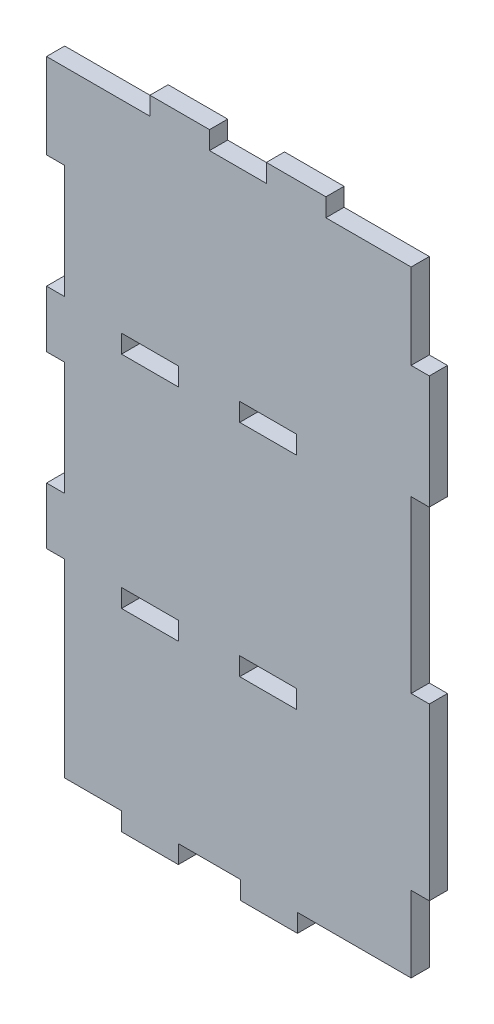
SolidWorks part; units mm, degrees
ref_plane "Front Plane" through (0, 0, 0) normal (0, 0, 1) x (1, 0, 0)
ref_plane "Top Plane" through (0, 0, 0) normal (0, 1, 0) x (1, 0, 0)
ref_plane "Right Plane" through (0, 0, 0) normal (1, 0, 0) x (0, 0, -1)
sketch "Sketch1" plane through (0, 0, 0) normal (0, 0, 1) x (1, 0, 0)
  line L0 (181.3709, 646.8) -> (233.7709, 646.8)
  line L1 (103.9709, 89) -> (158.7709, 89)
  line L2 (3.9709, 89) -> (3.9709, 630.8)
  line L3 (78.9709, 646.8) -> (131.3709, 646.8)
  line L4 (308.7709, 89) -> (308.7709, 630.8)
  line L5 (208.7709, 89) -> (158.7709, 89)
  line L6 (-4.0291, 555.8) -> (-4.0291, 455.8) construction
  line L7 (233.7709, 646.8) -> (233.7709, 630.8)
  line L8 (233.7709, 630.8) -> (308.7709, 630.8)
  line L9 (308.7709, 89) -> (208.7709, 89)
  line L10 (208.7709, 89) -> (208.7709, 73)
  line L11 (208.7709, 73) -> (158.7709, 73)
  line L12 (78.9709, 630.8) -> (3.9709, 630.8)
  line L13 (78.9709, 646.8) -> (78.9709, 630.8)
  line L14 (158.7709, 89) -> (158.7709, 73)
  line L15 (308.7709, 89) -> (257.9709, 89) construction
  line L16 (3.9709, 630.8) -> (-12.0291, 630.8)
  line L17 (131.3709, 646.8) -> (131.3709, 630.8)
  line L18 (131.3709, 630.8) -> (181.3709, 630.8)
  line L19 (181.3709, 646.8) -> (181.3709, 630.8)
  line L20 (3.9709, 630.8) -> (3.9709, 555.8)
  line L21 (3.9709, 555.8) -> (-12.0291, 555.8)
  line L22 (-12.0291, 630.8) -> (-12.0291, 555.8)
  line L23 (3.9709, 405.8) -> (3.9709, 305.8) construction
  line L24 (3.9709, 455.8) -> (-12.0291, 455.8)
  line L25 (3.9709, 455.8) -> (3.9709, 405.8)
  line L26 (3.9709, 405.8) -> (-12.0291, 405.8)
  line L27 (53.9709, 630.8) -> (53.9709, 453) construction
  line L28 (3.9709, 89) -> (53.9709, 89)
  line L29 (-12.0291, 455.8) -> (-12.0291, 405.8)
  line L30 (-12.0291, 255.8) -> (-12.0291, 155.8) construction
  line L31 (3.9709, 305.8) -> (-12.0291, 305.8)
  line L32 (3.9709, 305.8) -> (3.9709, 255.8)
  line L33 (3.9709, 255.8) -> (-12.0291, 255.8)
  line L34 (-12.0291, 305.8) -> (-12.0291, 255.8)
  line L40 (53.9709, 453) -> (103.9709, 453)
  line L41 (53.9709, 453) -> (53.9709, 437)
  line L42 (157.9709, 437) -> (207.9709, 437)
  line L43 (53.9709, 437) -> (103.9709, 437)
  line L44 (103.9709, 453) -> (103.9709, 437)
  line L45 (157.9709, 259.2) -> (207.9709, 259.2)
  line L46 (157.9709, 259.2) -> (157.9709, 243.2)
  line L47 (157.9709, 437) -> (157.9709, 453)
  line L48 (157.9709, 453) -> (207.9709, 453)
  line L49 (207.9709, 437) -> (207.9709, 453)
  line L50 (157.9709, 243.2) -> (207.9709, 243.2)
  line L51 (53.9709, 243.2) -> (103.9709, 243.2)
  line L52 (53.9709, 243.2) -> (53.9709, 259.2)
  line L53 (53.9709, 259.2) -> (103.9709, 259.2)
  line L54 (103.9709, 243.2) -> (103.9709, 259.2)
  line L55 (207.9709, 259.2) -> (207.9709, 243.2)
  line L58 (308.7709, 630.8) -> (308.7709, 555.8) construction
  line L59 (324.7709, 455.8) -> (324.7709, 305.8) construction
  line L60 (308.7709, 555.8) -> (324.7709, 555.8)
  line L61 (308.7709, 555.8) -> (308.7709, 455.8)
  line L62 (308.7709, 455.8) -> (324.7709, 455.8)
  line L63 (324.7709, 555.8) -> (324.7709, 455.8)
  line L64 (53.9709, 89) -> (103.9709, 89)
  line L65 (308.7709, 305.8) -> (324.7709, 305.8)
  line L66 (308.7709, 305.8) -> (308.7709, 155.8)
  line L67 (308.7709, 155.8) -> (324.7709, 155.8)
  line L68 (324.7709, 305.8) -> (324.7709, 155.8)
  line L69 (53.9709, 89) -> (53.9709, 73)
  line L70 (53.9709, 73) -> (103.9709, 73)
  line L71 (103.9709, 89) -> (103.9709, 73)
  point P41 (156.3709, 630.8)
extrude "Boss-Extrude1" add sketch "Sketch1" along normal blind 16
equation "\"thk\"= 16mm"
equation "\"D4@Sketch1\"=\"thk\""
equation "\"D5@Sketch1\"=\"thk\""
equation "\"D1@Boss-Extrude1\"=\"thk\""
equation "\"D8@Sketch1\"=\"thk\""
equation "\"D11@Sketch1\"=\"thk\""
equation "\"D14@Sketch1\"=\"thk\""
equation "\"D30@Sketch1\"=\"thk\""
equation "\"D33@Sketch1\"=\"thk\""
equation "\"D7@Sketch1\"=\"thk\""
equation "\"D40@Sketch1\"=\"thk\""
equation "\"D19@Sketch1\"=\"thk\""
equation "\"D24@Sketch1\"=\"thk\""
equation "\"D39@Sketch1\"=\"thk\""
equation "\"D43@Sketch1\"=\"thk\""
